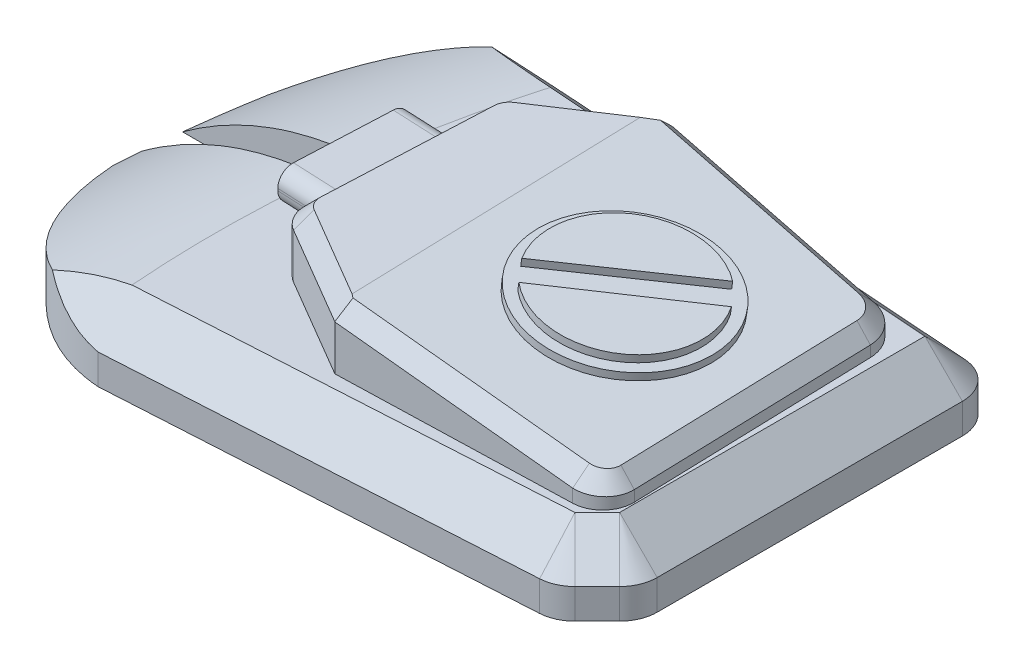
SolidWorks part; units mm, degrees
ref_plane "Front Plane" through (0, 0, 0) normal (0, 0, 1) x (1, 0, 0)
ref_plane "Top Plane" through (0, 0, 0) normal (0, 1, 0) x (1, 0, 0)
ref_plane "Right Plane" through (0, 0, 0) normal (1, 0, 0) x (0, 0, -1)
sketch "Sketch1" plane through (0, 0, 0) normal (0, 1, 0) x (1, 0, 0)
  line L0 (-81.8681, 0) -> (-78.1499, -2.5072)
  line L1 (-78.1499, -2.5072) -> (-81.5773, -4.9258)
  line L2 (-72.0719, 25.499) -> (-19.6192, 21.8297)
  line L3 (-14.9681, 16.8419) -> (-14.9681, -23.7752)
  line L7 (-16.4325, -27.3107) -> (-19.4045, -30.2827)
  line L8 (-22.6478, -31.7386) -> (-78.1499, -34.9878)
  line L10 (-81.5773, -4.9258) -> (-103.8652, -4.9258)
  line L11 (-81.8681, 0) -> (-103.8652, 0)
  arc A0 (-72.0719, 25.499) -> (-103.3704, 2.433) centre (-74.1654, -4.4279) ccw
  arc A1 (-14.9681, 16.8419) -> (-19.6192, 21.8297) centre (-19.9681, 16.8419) ccw
  arc A2 (-16.4325, -27.3107) -> (-14.9681, -23.7752) centre (-19.9681, -23.7752) ccw
  arc A3 (-22.6478, -31.7386) -> (-19.4045, -30.2827) centre (-22.94, -26.7471) ccw
  spline S0 degree 3 poles (-103.8652, 0) (-103.7268, 0.8036) (-103.5569, 1.639) (-103.3704, 2.433) knots 0 0 0 0 0.064927 0.064927 0.064927 0.064927
  spline S1 degree 3 poles (-103.8652, -4.9258) (-100.0329, -16.9659) (-93.2339, -33.8759) (-78.1499, -34.9878) knots 0 0 0 0 1 1 1 1
  dimension "D1" = 30
  dimension "D2" = 5
  dimension "D3" = 5
  dimension "D4" = 5
extrude "Boss-Extrude1" add sketch "Sketch1" along normal blind 9
sketch "Sketch2" plane through (1.7744, 0, 30.3089) normal (0.0584, 0, 0.9983) x (0.9983, 0, -0.0584)
  line L0 (-103.9755, 0) -> (-103.9755, 9)
  line L1 (-103.9755, 9) -> (-80.0611, 9)
  spline S0 degree 2 poles (-80.0611, 9) (-93.1761, 7.9584) (-103.9755, 0) knots 0 0 0 1 1 1
sketch "Sketch3" plane through (0, 9, 0) normal (0, 1, 0) x (1, 0, 0)
  line L0 (-102.0234, -36.3854) -> (-78.1499, -34.9878) construction
  spline S0 degree 2 poles (-78.1499, -34.9878) (-81.5942, -4.049) (-72.0719, 25.499) knots 0 0 0 1 1 1
sweep "Cut-Sweep1" cut profiles "Sketch2" path "Sketch3"
sketch "Sketch4" plane through (0, 9, 0) normal (0, 1, 0) x (1, 0, 0)
  line L0 (-21.1291, 10.7498) -> (-20.17, -21.622)
  line L1 (-24.1442, -25.839) -> (-54.8833, -26.7498)
  line L2 (-54.8833, -26.7498) -> (-68.1859, -18.9437)
  line L3 (-70.2053, -15.2237) -> (-69.201, 6.8715)
  line L4 (-67.3649, 10.1052) -> (-54.8833, 18.3434)
  line L5 (-54.8833, 18.3434) -> (-25.6562, 15.5795)
  arc A0 (-21.1291, 10.7498) -> (-25.6562, 15.5795) centre (-26.1269, 10.6017) ccw
  arc A1 (-24.1442, -25.839) -> (-20.17, -21.622) centre (-24.2656, -21.7434) ccw
  arc A2 (-67.3649, 10.1052) -> (-69.201, 6.8715) centre (-65.1078, 6.6855) ccw
  arc A3 (-68.1859, -18.9437) -> (-70.2053, -15.2237) centre (-66.1121, -15.4098) cw
  dimension "D1" = 5
  dimension "D2" = 4.0974
  dimension "D3" = 4.0974
  dimension "D4" = 4.0974
extrude "Boss-Extrude2" add sketch "Sketch4" along normal blind 8
sketch "Sketch5" plane through (0.7437, 0, 25.1016) normal (0.0296, 0, 0.9996) x (0.9996, 0, -0.0296)
  line L0 (-55.6514, 17) -> (-14.1372, 11.281)
  line L1 (-14.1372, 11.281) -> (-14.1372, 17)
  line L2 (-14.1372, 17) -> (-55.6514, 17)
extrude "Cut-Extrude1" cut sketch "Sketch5" against normal blind 49
chamfer "Chamfer1" distance 2 angle 45 10 edges at (-40.2697, 14.8094, -16.9614) (-61.7793, 17, -13.7918) (-22.4789, 12.3716, -14.0211) (-68.6709, 17, -8.7086) (-20.6495, 12.1991, 5.4361) (-69.7031, 17, 4.1761) (-21.2837, 12.3644, 24.5536) (-69.7131, 17, 17.3646) (-39.5137, 14.8818, 26.2944) (-61.5346, 17, 22.8467)
sketch "Sketch6" plane through (-69.37, 0, -3.1532) normal (-0.999, 0, -0.0454) x (-0.0454, 0, 0.999)
  line L1 (0.924, 9.7084) -> (13.6428, 9.7084)
  line L2 (-1.076, 11.7084) -> (-1.076, 11.9853)
  line L3 (0.924, 13.9853) -> (13.6428, 13.9853)
  line L4 (15.6428, 11.7084) -> (15.6428, 11.9853)
  line L5 (-1.076, 9.7084) -> (15.6428, 13.9853) construction
  line L6 (-1.076, 13.9853) -> (15.6428, 9.7084) construction
  line L7 (2.5691, 10.9721) -> (11.9978, 10.9721)
  line L8 (2.5691, 10.9721) -> (2.5691, 12.7217)
  line L9 (2.5691, 12.7217) -> (11.9978, 12.7217)
  line L10 (11.9978, 10.9721) -> (11.9978, 12.7217)
  line L11 (2.5691, 10.9721) -> (11.9978, 12.7217) construction
  line L12 (2.5691, 12.7217) -> (11.9978, 10.9721) construction
  arc A0 (0.924, 13.9853) -> (-1.076, 11.9853) centre (0.924, 11.9853) ccw
  arc A1 (0.924, 9.7084) -> (-1.076, 11.7084) centre (0.924, 11.7084) cw
  arc A2 (13.6428, 9.7084) -> (15.6428, 11.7084) centre (13.6428, 11.7084) ccw
  arc A3 (13.6428, 13.9853) -> (15.6428, 11.9853) centre (13.6428, 11.9853) cw
  point P0 (7.2834, 11.8469)
  point P5 (7.2834, 11.8469)
  dimension "D1" = 2
  dimension "D2" = 2
  dimension "D3" = 2
  dimension "D4" = 2
extrude "Boss-Extrude3" add sketch "Sketch6" along normal blind 7
sketch "Sketch7" plane through (1.2613, 9.1596, -0.0374) normal (0.1364, 0.9906, -0.004) x (0.9907, -0.1364, 0.0006)
  line L0 (-48.9106, -9.9211) -> (-34.1533, 3.5388)
  line L1 (-46.6089, -12.5871) -> (-31.6158, 0.8603)
  circle A0 centre (-40.1611, -4.6941) radius 10.1919
extrude "Boss-Extrude4" add sketch "Sketch7" along normal blind 2 contours L0 A0 | L1 A0
sketch "Sketch8" plane through (1.2613, 9.1596, -0.0374) normal (0.1364, 0.9906, -0.004) x (0.9907, -0.1364, 0.0006)
  circle A0 centre (-40.1611, -4.6941) radius 11.6275
extrude "Boss-Extrude5" add sketch "Sketch8" along normal blind 1
chamfer "Chamfer2" distance 5 angle 45 7 edges at (-16.3113, 9, -20.2518) (-14.9681, 9, 3.4667) (-15.3487, 9, 25.6886) (-17.9185, 9, 28.7967) (-20.8924, 9, 31.3086)
